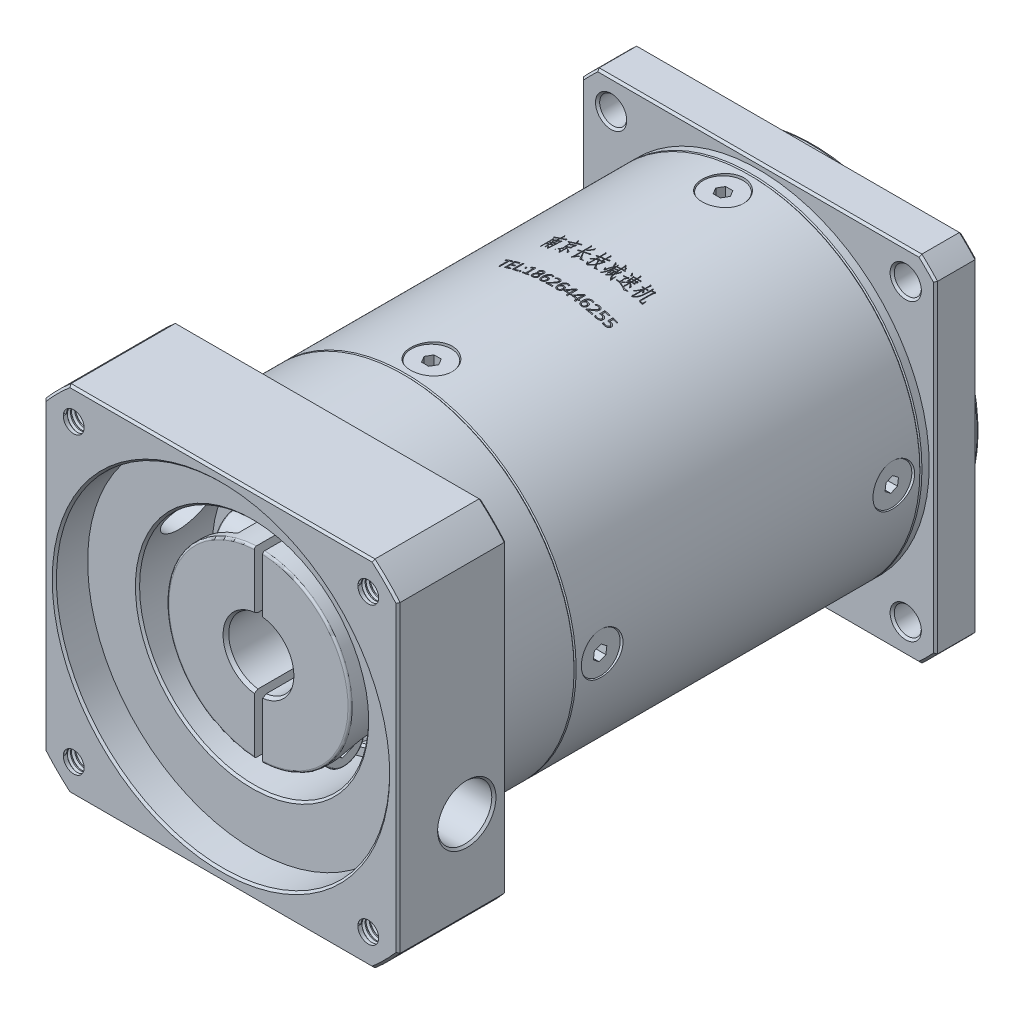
SolidWorks part; units mm, degrees
ref_plane "前视基准面" through (0, 0, 0) normal (0, 0, 1) x (1, 0, 0)
ref_plane "上视基准面" through (0, 0, 0) normal (0, 1, 0) x (1, 0, 0)
ref_plane "右视基准面" through (0, 0, 0) normal (1, 0, 0) x (0, 0, -1)
imported_body "16-80-100-M6-1-solid1"
imported_body "16-80-100-M6-1-solid2"
imported_body "16-80-100-M6-1-solid3"
imported_body "16-80-100-M6-1-solid4"
imported_body "ZF80-K15-L3-3-solid1"
imported_body "ZF80-K15-L3-3-solid2"
imported_body "ZF80-K15-L3-3-solid3"
imported_body "ZF80-K15-L3-3-solid4"
imported_body "ZF80-K15-L3-3-solid5"
imported_body "ZF80-K15-L3-3-solid6"
imported_body "ZF80-K15-L3-3-solid7"
imported_body "ZF80-K15-L3-3-solid8"
imported_body "ZF80-K15-L3-3-solid9"
sketch "草图1" plane through (0, 0, -93.7125) normal (0, 0, -1) x (-1, 0, 0)
  circle A0 centre (88.8934, 24.356) radius 10.7785
  dimension "D1" = 21.5571
extrude "凸台-拉伸1" add sketch "草图1" along normal blind 5
